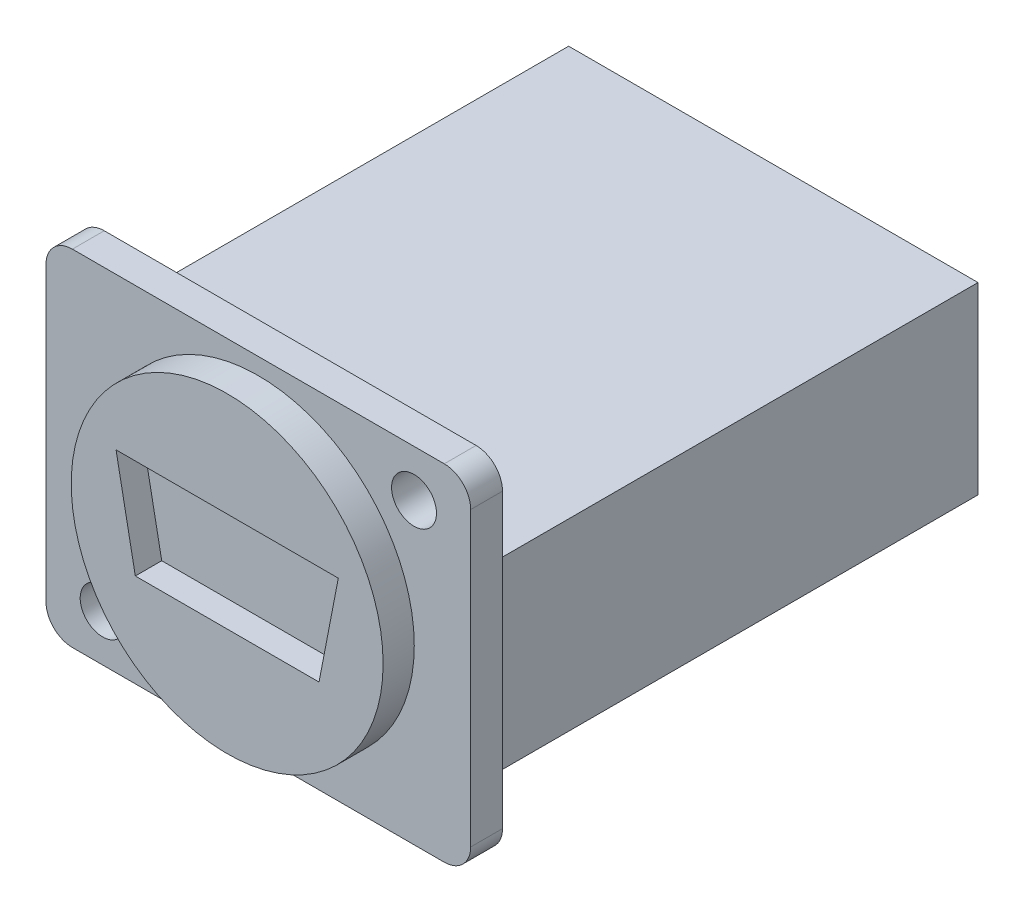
SolidWorks part; units mm, degrees
ref_plane "前视基准面" through (0, 0, 0) normal (0, 0, 1) x (1, 0, 0)
ref_plane "上视基准面" through (0, 0, 0) normal (0, 1, 0) x (1, 0, 0)
ref_plane "右视基准面" through (0, 0, 0) normal (1, 0, 0) x (0, 0, -1)
other "Configuration Table"
sketch "草图1" plane through (0, 0, 0) normal (0, 0, 1) x (1, 0, 0)
  line L1 (-14.08, 13.065) -> (14.08, 13.065)
  line L2 (-16.08, 11.065) -> (-16.08, -11.065)
  line L3 (-14.08, -13.065) -> (14.08, -13.065)
  line L4 (16.08, 11.065) -> (16.08, -11.065)
  line L5 (-16.08, 13.065) -> (16.08, -13.065) construction
  line L6 (-16.08, -13.065) -> (16.08, 13.065) construction
  arc A0 (-16.08, -11.065) -> (-14.08, -13.065) centre (-14.08, -11.065) ccw
  arc A1 (14.08, -13.065) -> (16.08, -11.065) centre (14.08, -11.065) ccw
  arc A2 (14.08, 13.065) -> (16.08, 11.065) centre (14.08, 11.065) cw
  arc A3 (-14.08, 13.065) -> (-16.08, 11.065) centre (-14.08, 11.065) ccw
  point P0 (0, 0)
  dimension "D3" = 2
  dimension "D1" = 32.16
  dimension "D2" = 26.13
extrude "凸台-拉伸1" add sketch "草图1" along normal blind 2.41
sketch "草图2" plane through (0, 0, 2.41) normal (0, 0, 1) x (1, 0, 0)
  circle A0 centre (0, 0) radius 11.81
  dimension "D1" = 23.62
extrude "凸台-拉伸2" add sketch "草图2" along normal blind 2.36
sketch "草图3" plane through (0, 0, 2.41) normal (0, 0, 1) x (1, 0, 0)
  circle A0 centre (11.79, 9.525) radius 1.7
  circle A1 centre (-11.79, -9.525) radius 1.7
  dimension "D1" = 3.4
  dimension "D2" = 23.58
  dimension "D3" = 19.05
  dimension "D5" = 9.525
  dimension "D4" = 11.79
extrude "切除-拉伸1" cut sketch "草图3" against normal through all
sketch "草图4" plane through (0, 0, 4.77) normal (0, 0, 1) x (1, 0, 0)
  line L0 (0, 0) -> (0, 6.023) construction
  line L1 (-8.4159, 3.9139) -> (8.4159, 3.9139)
  line L2 (8.4159, 3.9139) -> (6.9558, -3.63)
  line L3 (6.9558, -3.63) -> (-6.9558, -3.63)
  line L4 (-8.4159, 3.9139) -> (-6.9558, -3.63)
  point P8 (0, -3.63)
  point P9 (0, 3.9139)
extrude "切除-拉伸2" cut sketch "草图4" against normal blind 2
sketch "草图5" plane through (0, 0, 0) normal (0, 0, -1) x (-1, 0, 0)
  line L0 (-14.08, 13.065) -> (14.08, 13.065) construction
  line L5 (15.5, -7.765) -> (-15.5, -7.765)
  line L6 (15.5, -7.765) -> (15.5, 6.165)
  line L7 (15.5, 6.165) -> (-15.5, 6.165)
  line L8 (-15.5, -7.765) -> (-15.5, 6.165)
  line L9 (15.5, -7.765) -> (-15.5, 6.165) construction
  line L10 (15.5, 6.165) -> (-15.5, -7.765) construction
  line L11 (14.08, -13.065) -> (-14.08, -13.065) construction
  point P0 (0, -0.8)
  point P6 (0, 0)
  dimension "D1" = 6.9
  dimension "D2" = 5.3
  dimension "D3" = 31
extrude "凸台-拉伸3" add sketch "草图5" along normal blind 36.59
